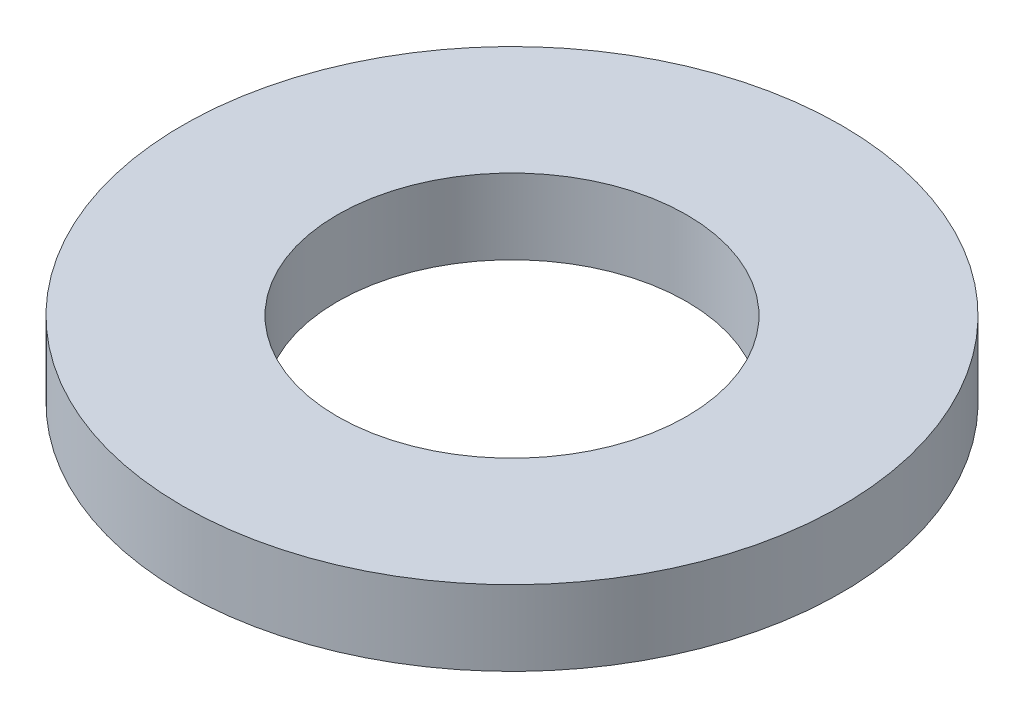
SolidWorks part; units mm, degrees
ref_plane "Front Plane" through (0, 0, 0) normal (0, 0, 1) x (1, 0, 0)
ref_plane "Top Plane" through (0, 0, 0) normal (0, 1, 0) x (1, 0, 0)
ref_plane "Right Plane" through (0, 0, 0) normal (1, 0, 0) x (0, 0, -1)
sketch "Sketch1" plane through (0, 0, 0) normal (0, 1, 0) x (1, 0, 0)
  circle A0 centre (0, 0) radius 6.35
  circle A1 centre (0, 0) radius 3.3655
  dimension "D1" = 12.7
  dimension "D2" = 6.731
extrude "Boss-Extrude1" add sketch "Sketch1" along normal blind 1.4478
